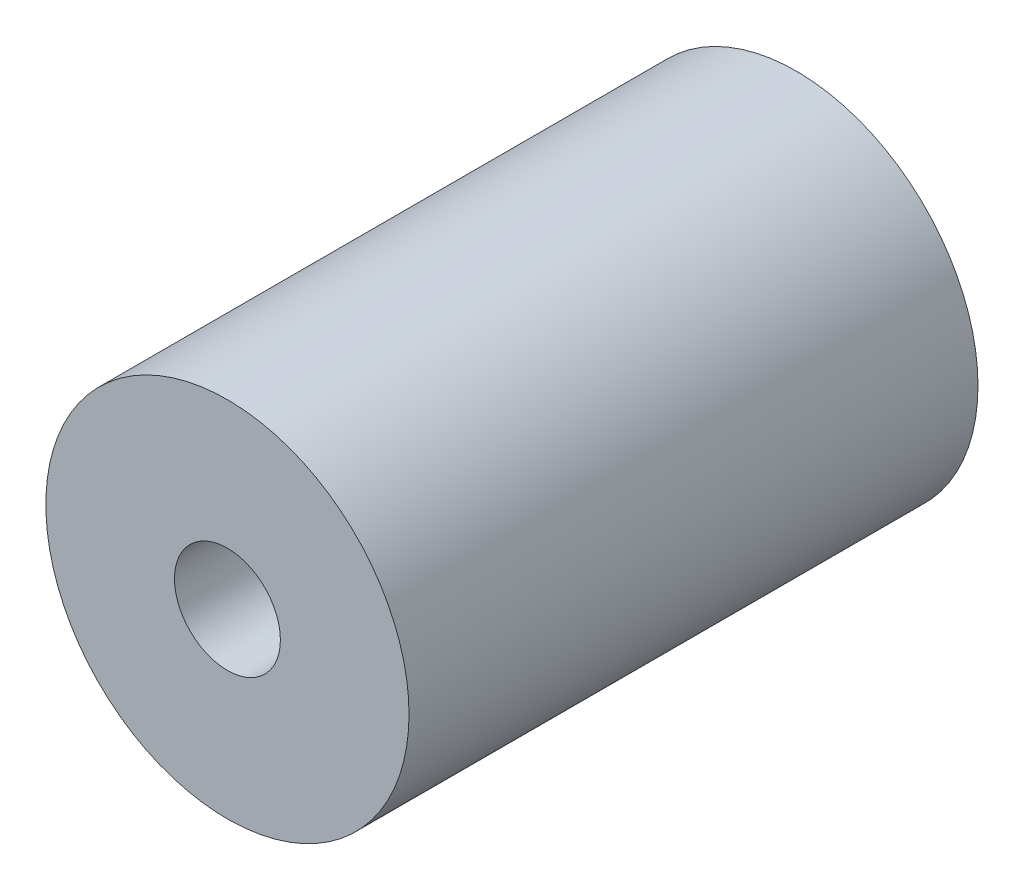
SolidWorks part; units mm, degrees
ref_plane "Plan de face" through (0, 0, 0) normal (0, 0, 1) x (1, 0, 0)
ref_plane "Plan de dessus" through (0, 0, 0) normal (0, 1, 0) x (1, 0, 0)
ref_plane "Plan de droite" through (0, 0, 0) normal (1, 0, 0) x (0, 0, -1)
sketch "Esquisse1" plane through (0, 0, 0) normal (0, 0, 1) x (1, 0, 0)
  circle A0 centre (0, 0) radius 1.75
  circle A1 centre (0, 0) radius 6
  dimension "D1" = 3.5
  dimension "D2" = 12
extrude "Boss.-Extru.1" add sketch "Esquisse1" along normal blind 18.8
